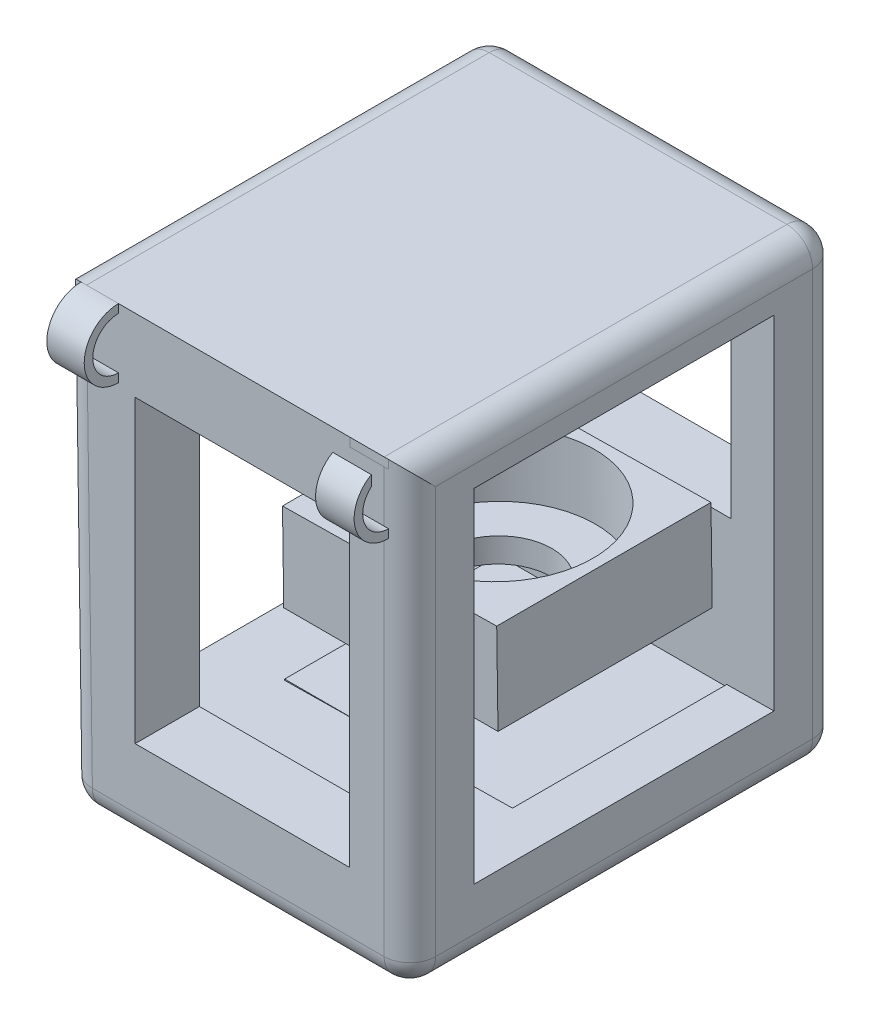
SolidWorks part; units mm, degrees
ref_plane "Front Plane" through (0, 0, 0) normal (0, 0, 1) x (1, 0, 0)
ref_plane "Top Plane" through (0, 0, 0) normal (0, 1, 0) x (1, 0, 0)
ref_plane "Right Plane" through (0, 0, 0) normal (1, 0, 0) x (0, 0, -1)
sketch "Sketch2" plane through (0, 0, 0) normal (0, 0, 1) x (1, 0, 0)
  line L0 (0, 0) -> (101.6, 0)
  line L1 (101.6, 0) -> (101.6, 139.7)
  line L2 (101.6, 139.7) -> (35.9117, 171.45)
  line L3 (35.9117, 171.45) -> (-2.1883, 152.4)
  line L4 (-2.1883, 152.4) -> (0, 0)
  dimension "D1" = 101.6
  dimension "D2" = 139.7
  dimension "D3" = 152.4
  dimension "D4" = 38.1
  dimension "D5" = 171.45
extrude "Boss-Extrude1" add sketch "Sketch2" along normal blind 127
sketch "Sketch3" plane through (0, 0, 0) normal (-0.9999, -0.0144, 0) x (0, 0, 1)
  line L0 (19.05, 120.65) -> (107.95, 120.65)
  line L1 (19.05, 120.65) -> (19.05, 19.05)
  line L2 (107.95, 120.65) -> (107.95, 19.05)
  line L3 (19.05, 19.05) -> (107.95, 19.05)
  line L4 (0, 152.4157) -> (0, 0) construction
  line L5 (127, 152.4157) -> (127, 0) construction
  line L6 (127, 0) -> (0, 0) construction
  dimension "D1" = 101.6
  dimension "D2" = 19.05
  dimension "D3" = 19.05
  dimension "D4" = 19.05
extrude "Cut-Extrude1" cut sketch "Sketch3" against normal blind 127
sketch "Sketch7" plane through (101.6, 0, 0) normal (1, 0, 0) x (0, 0, -1)
  line L0 (-95.25, 139.7) -> (-31.75, 139.7)
  line L1 (-95.25, 139.7) -> (-95.25, 177.8)
  line L2 (-31.75, 139.7) -> (-31.75, 177.8)
  line L3 (-95.25, 177.8) -> (-31.75, 177.8)
  line L4 (-127, 139.7) -> (0, 139.7) construction
  line L6 (-127, 139.7) -> (-127, 171.45) construction
  line L7 (0, 139.7) -> (0, 171.45) construction
  dimension "D1" = 31.75
  dimension "D2" = 31.75
  dimension "D3" = 38.1
extrude "Cut-Extrude4" cut sketch "Sketch7" against normal blind 323.85
sketch "Sketch10" plane through (0, 0, 127) normal (0, 0, 1) x (1, 0, 0)
  line L0 (20.1897, 114.3) -> (20.1897, 25.4)
  line L1 (20.1897, 114.3) -> (83.6897, 114.3)
  line L2 (20.1897, 25.4) -> (83.6897, 25.4)
  line L3 (83.6897, 114.3) -> (83.6897, 25.4)
  line L4 (0, 0) -> (101.6, 0) construction
  dimension "D1" = 63.5
  dimension "D2" = 88.9
  dimension "D3" = 25.4
extrude "Cut-Extrude7" cut sketch "Sketch10" against normal blind 24.13
sketch "Sketch12" plane through (0, 0, 0) normal (0, 0, -1) x (-1, 0, 0)
  line L4 (-101.6, 0) -> (-101.6, 139.7) construction
  line L5 (-88.9, 120.65) -> (-12.7, 120.65)
  line L6 (-88.9, 120.65) -> (-88.9, 63.5)
  line L7 (-88.9, 63.5) -> (-12.7, 63.5)
  line L8 (-12.7, 120.65) -> (-12.7, 63.5)
  dimension "D1" = 76.2
  dimension "D2" = 12.7
  dimension "D3" = 19.05
  dimension "D4" = 57.15
extrude "Cut-Extrude9" cut sketch "Sketch12" against normal blind 27.432
sketch "Sketch13" plane through (101.6, 0, 0) normal (1, 0, 0) x (0, 0, -1)
  line L0 (-127, 0) -> (-127, 139.7) construction
  line L1 (-127, 139.7) -> (-95.25, 139.7) construction
  arc A0 (-127, 133.35) -> (-127, 118.11) centre (-126.9995, 125.73) ccw
  dimension "D1" = 7.62
  dimension "D2" = 6.35
extrude "Extrude-Thin1" add sketch "Sketch13" against normal through all separate body thin
sketch "Sketch14" plane through (0, 0, 127) normal (0, 0, 1) x (1, 0, 0)
  line L0 (-2.1883, 135.89) -> (-2.1883, 152.4)
  line L1 (-2.1883, 152.4) -> (35.9117, 171.45)
  line L2 (35.9117, 171.45) -> (101.6, 139.7)
  line L3 (101.6, 139.7) -> (101.6, 135.89)
  line L4 (101.6, 135.89) -> (-2.1883, 135.89)
extrude "Cut-Extrude10" cut sketch "Sketch14" against normal blind 177.038
sketch "Sketch15" plane through (0, 0, 127) normal (0, 0, 1) x (1, 0, 0)
  line L0 (-2.1883, 135.89) -> (101.6, 135.89) construction
  line L1 (15.24, 115.57) -> (83.82, 115.57)
  line L2 (15.24, 115.57) -> (15.24, 135.89)
  line L3 (15.24, 135.89) -> (83.82, 135.89)
  line L4 (83.82, 115.57) -> (83.82, 135.89)
  line L8 (-2.1883, 115.57) -> (4.1617, 115.57)
  line L9 (-2.1883, 115.57) -> (-2.1883, 135.89)
  line L10 (-2.1883, 135.89) -> (4.1617, 135.89)
  line L11 (4.1617, 115.57) -> (4.1617, 135.89)
  line L12 (101.6, 135.89) -> (95.25, 135.89)
  line L13 (101.6, 135.89) -> (101.6, 115.57)
  line L14 (101.6, 115.57) -> (95.25, 115.57)
  line L15 (95.25, 135.89) -> (95.25, 115.57)
  dimension "D1" = 20.32
  dimension "D2" = 68.58
  dimension "D3" = 6.35
  dimension "D4" = 6.35
extrude "Cut-Extrude11" cut sketch "Sketch15" along normal blind 25.4
sketch "Sketch17" plane through (0, 0, 0) normal (-0.9999, -0.0144, 0) x (0, 0, 1)
  line L1 (19.05, 19.05) -> (82.55, 19.05)
  line L2 (19.05, 19.05) -> (19.05, 63.5)
  line L3 (19.05, 63.5) -> (82.55, 63.5)
  line L4 (82.55, 19.05) -> (82.55, 63.5)
  dimension "D1" = 63.5
  dimension "D2" = 44.45
extrude "Boss-Extrude2" add sketch "Sketch17" against normal blind 63.5 from offset 20.32
sketch "Sketch19" plane through (-0.9117, 63.4935, 0) normal (-0.0144, 0.9999, 0) x (0.9999, 0.0144, 0)
  line L0 (83.82, -82.55) -> (83.82, -19.05) construction
  line L1 (83.82, -19.05) -> (20.32, -19.05) construction
  circle A0 centre (52.07, -50.8) radius 28.575
  dimension "D1" = 57.15
  dimension "D2" = 31.75
  dimension "D3" = 31.75
extrude "Cut-Extrude12" cut sketch "Sketch19" against normal blind 19.05
sketch "Sketch20" plane through (-0.6382, 44.4454, 0) normal (-0.0144, 0.9999, 0) x (0.9999, 0.0144, 0)
  circle A0 centre (52.07, -50.8) radius 15.875
  circle A1 centre (52.07, -50.8) radius 28.575 construction
  dimension "D1" = 31.75
  dimension "D2" = 0
extrude "Cut-Extrude13" cut sketch "Sketch20" against normal blind 11.43
sketch "Sketch21" plane through (0, 0, 82.55) normal (0, 0, 1) x (1, 0, 0)
  line L5 (17.7053, 37.8484) -> (17.7053, 19.685)
  line L6 (87.5783, 37.8484) -> (87.5783, 19.685)
  line L8 (17.7053, 19.685) -> (87.5783, 19.685)
  line L9 (17.7053, 37.8484) -> (87.5783, 37.8484)
  line L11 (0, 0) -> (101.6, 0) construction
  dimension "D1" = 19.685
extrude "Cut-Extrude14" cut sketch "Sketch21" against normal blind 63.5
fillet "Fillet1" radius 7.62 11 edges at (-0.9756, 67.945, 0) (101.6, 67.945, 0) (-0.9756, 67.945, 127) (101.6, 67.945, 127) (50.8, 0, 127) (0, 0, 63.5) (50.8, 0, 0) (101.6, 0, 63.5) (-1.9512, 135.89, 63.5) (49.8244, 135.89, 0) (101.6, 135.89, 63.5)
sketch "Sketch22" plane through (0, 135.89, 0) normal (0, 1, 0) x (1, 0, 0)
  line L0 (83.82, -127.0002) -> (95.25, -127.0002)
  line L1 (83.82, -127.0002) -> (83.82, -132.0802)
  line L2 (95.25, -127.0002) -> (95.25, -132.0802)
  line L3 (83.82, -132.0802) -> (95.25, -132.0802)
  dimension "D1" = 5.08
extrude "Cut-Extrude15" cut sketch "Sketch22" against normal blind 10.922
